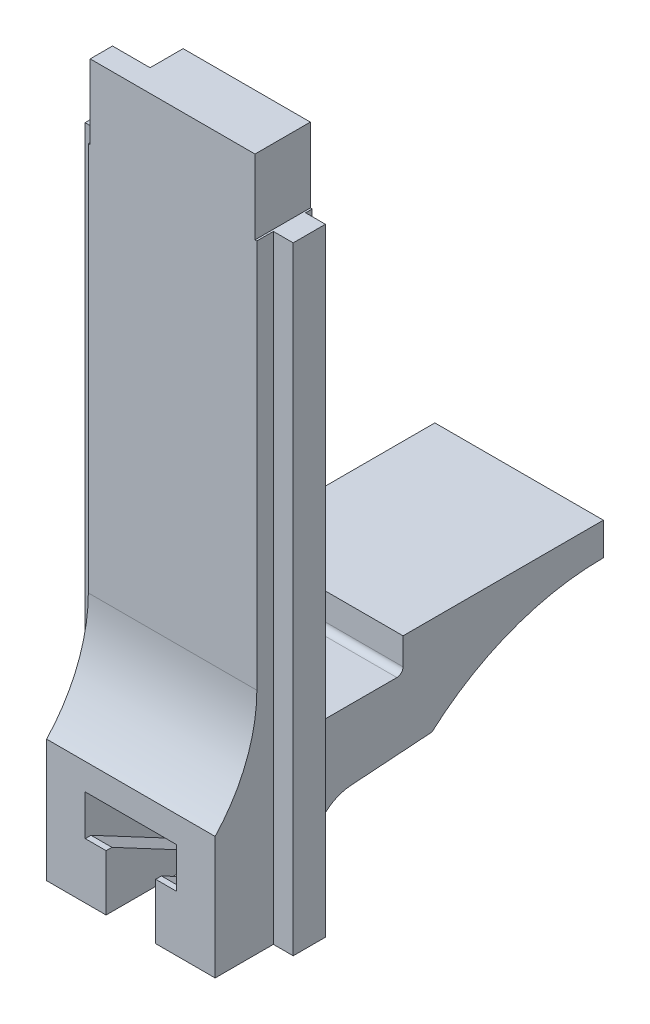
SolidWorks part; units mm, degrees
ref_plane "Спереди" through (0, 0, 0) normal (0, 0, 1) x (1, 0, 0)
ref_plane "Сверху" through (0, 0, 0) normal (0, 1, 0) x (1, 0, 0)
ref_plane "Справа" through (0, 0, 0) normal (1, 0, 0) x (0, 0, -1)
sketch "Эскиз1" plane through (0, 0, 0) normal (1, 0, 0) x (0, 0, -1)
  line L0 (0, 0) -> (-5.969, 0)
  line L1 (-5.969, 0) -> (-5.969, 7.5406)
  line L2 (0, 0) -> (0, 3.5496)
  line L3 (2.3628, 6.0834) -> (7.3643, 6.4332)
  line L4 (-3.4036, 14.0437) -> (-3.4036, 42.545)
  line L5 (-3.4036, 42.545) -> (0, 42.545)
  line L6 (0, 42.545) -> (0, 10.795)
  line L7 (0.381, 10.414) -> (5.207, 10.414)
  line L8 (5.588, 10.795) -> (5.588, 12.446)
  line L9 (5.588, 12.446) -> (17.907, 12.446)
  line L10 (17.907, 12.446) -> (17.907, 10.4394)
  line L11 (17.907, 10.4394) -> (12.7818, 10.4394) construction
  arc A0 (-5.969, 7.5406) -> (-3.4036, 14.0437) centre (-12.9286, 14.0437) ccw
  arc A1 (7.3643, 6.4332) -> (17.907, 10.4394) centre (17.907, -5.4356) cw
  arc A2 (0, 3.5496) -> (2.3628, 6.0834) centre (2.54, 3.5496) cw
  arc A3 (5.207, 10.414) -> (5.588, 10.795) centre (5.207, 10.795) ccw
  arc A4 (0, 10.795) -> (0.381, 10.414) centre (0.381, 10.795) ccw
  point P19 (0, 5.9182)
  dimension "D7" = 9.525
  dimension "D10" = 15.875
  dimension "D14" = 2.54
  dimension "D15" = 0.381
  dimension "D1" = 42.545
  dimension "D2" = 2.0066
  dimension "D3" = 10.414
  dimension "D4" = 12.446
  dimension "D5" = 7.5406
  dimension "D6" = 5.969
  dimension "D8" = 3.4036
  dimension "D9" = 5.588
  dimension "D11" = 23.876
  dimension "D12" = 4
  dimension "D13" = 6.5278
extrude "Бобышка-Вытянуть1" add sketch "Эскиз1" along normal mid plane 10.3632
sketch "Эскиз2" plane through (0, 0, 0) normal (0, -1, 0) x (1, 0, 0)
  line L0 (0, 0) -> (0, 13.6938) construction
  line L1 (5.1816, 5.969) -> (-5.1816, 5.969) construction
  line L2 (6.4008, 2.3876) -> (-6.4008, 2.3876)
  line L3 (6.4008, 2.3876) -> (6.4008, 0.4064)
  line L4 (6.4008, 0.4064) -> (-6.4008, 0.4064)
  line L5 (-6.4008, 2.3876) -> (-6.4008, 0.4064)
  dimension "D1" = 1.9812
  dimension "D2" = 5.5626
  dimension "D3" = 12.8016
extrude "Бобышка-Вытянуть2" add sketch "Эскиз2" against normal up to surface (42.545 mm away)
sketch "Эскиз3" plane through (0, 0, 0) normal (1, 0, 0) x (0, 0, -1)
  line L0 (-5.969, 0) -> (-2.3876, 0) construction
  line L1 (17.907, 5.9182) -> (-5.969, 5.9182)
  line L2 (17.907, 5.9182) -> (17.907, 0)
  line L3 (17.907, 0) -> (-5.969, 0)
  line L4 (-5.969, 5.9182) -> (-5.969, 0)
  line L5 (-5.969, 7.5406) -> (-5.969, 0) construction
  line L6 (17.907, 12.446) -> (5.588, 12.446) construction
  line L7 (17.907, 10.4394) -> (17.907, 12.446) construction
  dimension "D1" = 6.5278
extrude "Вырез-Вытянуть1" cut sketch "Эскиз3" against normal mid plane 3.048
sketch "Эскиз4" plane through (0, 0, 0) normal (1, 0, 0) x (0, 0, -1)
  line L0 (-5.969, 5.9182) -> (-5.969, 3.429)
  line L1 (-5.969, 3.429) -> (-5.6134, 3.429)
  line L2 (-5.6134, 3.429) -> (-0.4064, 0.6604)
  line L3 (-0.4064, 0.6604) -> (17.907, 0.6604)
  line L4 (17.907, 0.6604) -> (17.907, 5.9182)
  line L5 (17.907, 5.9182) -> (-5.969, 5.9182)
  line L6 (1.6227, 5.9182) -> (-5.969, 5.9182) construction
  line L7 (-5.969, 7.5406) -> (-5.969, 0) construction
  line L9 (-0.4064, 42.545) -> (-0.4064, 0) construction
  line L10 (17.907, 12.446) -> (5.588, 12.446) construction
  line L11 (17.907, 10.4394) -> (17.907, 12.446) construction
  dimension "D1" = 28
  dimension "D2" = 3.429
  dimension "D3" = 11.7856
extrude "Вырез-Вытянуть2" cut sketch "Эскиз4" against normal mid plane 5.6134
sketch "Эскиз7" plane through (0, 0, 0) normal (0, 0, -1) x (-1, 0, 0)
  line L0 (-5.1816, 42.545) -> (5.1816, 42.545) construction
  line L1 (-5.0673, 42.545) -> (-6.4008, 42.545)
  line L2 (-5.0673, 42.545) -> (-5.0673, 37.973)
  line L3 (-5.0673, 37.973) -> (-6.4008, 37.973)
  line L4 (-6.4008, 42.545) -> (-6.4008, 37.973)
  line L5 (0, 0) -> (0, 56.9525) construction
  line L6 (5.0673, 42.545) -> (6.4008, 42.545)
  line L7 (5.0673, 42.545) -> (5.0673, 37.973)
  line L8 (5.0673, 37.973) -> (6.4008, 37.973)
  line L9 (6.4008, 42.545) -> (6.4008, 37.973)
  line L10 (-6.4008, 42.545) -> (-6.4008, 0) construction
  line L11 (6.4008, 42.545) -> (6.4008, 0) construction
  dimension "D1" = 10.1346
  dimension "D2" = 37.973
extrude "Вырез-Вытянуть4" cut sketch "Эскиз7" against normal through all
sketch "Эскиз5" plane through (0, 0, 0) normal (0, 1, 0) x (1, 0, 0)
  line L0 (-0.0664, -2.032) -> (-6.4008, -2.032)
  line L1 (-6.4008, -0.4064) -> (-6.4008, -2.3876) construction
  line L2 (-6.4008, -2.032) -> (-6.4008, 0)
  line L3 (-6.4008, 0) -> (4.2291, 0)
  line L5 (5.1816, -5.969) -> (-5.1816, -5.969) construction
  line L7 (5.0673, 0) -> (-5.0673, 0) construction
  line L9 (5.0673, -3.4036) -> (5.0673, 0) construction
  arc A0 (4.2291, 0) -> (-0.0664, -2.032) centre (-0.0664, 3.5243) cw
  dimension "D1" = 5.5562
  dimension "D2" = 3.937
  dimension "D3" = 0.8382
extrude "Вырез-Вытянуть3" cut sketch "Эскиз5" along normal blind 2.7432 from offset 38.1
sketch "Эскиз9" plane through (0, 0, 0) normal (0, 0, -1) x (-1, 0, 0)
  line L0 (-4.2291, 38.1) -> (5.0673, 38.1) construction
  line L1 (5.0673, 42.545) -> (2.7559, 42.545)
  line L2 (5.0673, 42.545) -> (5.0673, 38.1)
  line L3 (5.0673, 38.1) -> (2.7559, 38.1)
  line L4 (2.7559, 42.545) -> (2.7559, 38.1)
  line L5 (-5.0673, 37.973) -> (-5.0673, 42.545) construction
  dimension "D1" = 7.8232
extrude "Вырез-Вытянуть5" cut sketch "Эскиз9" against normal up to surface (2.032 mm away)
